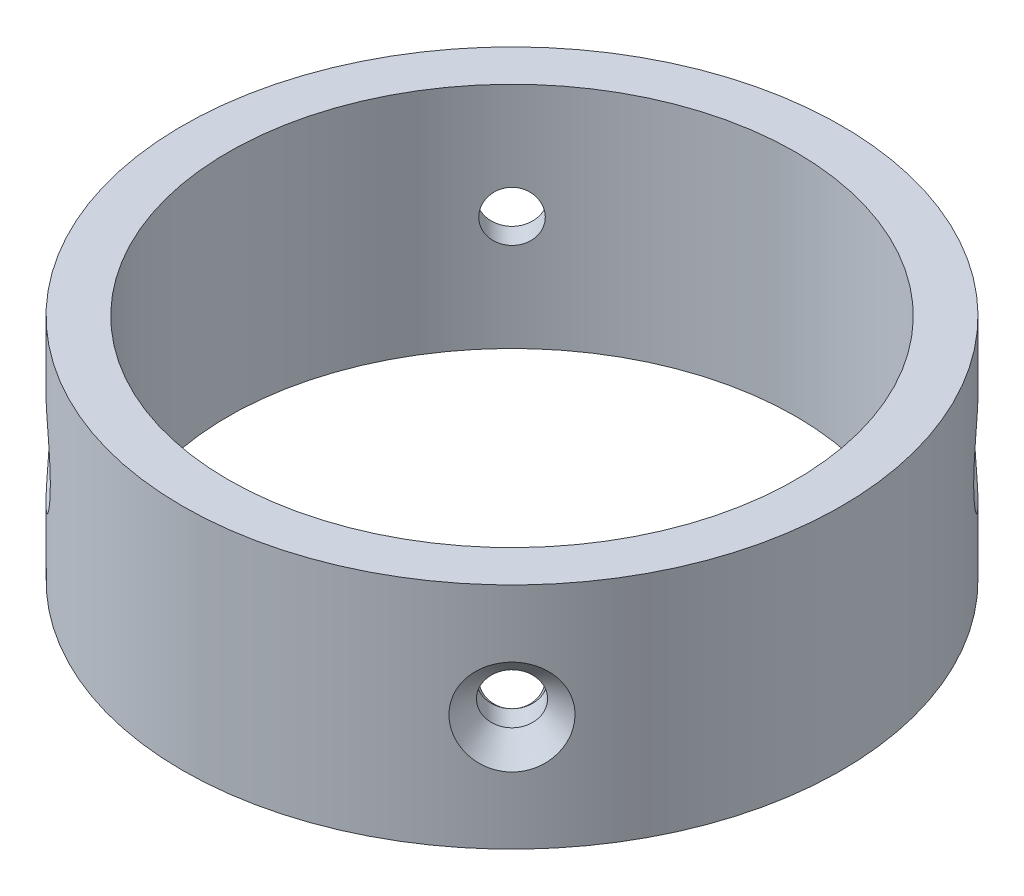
SolidWorks part; units mm, degrees
ref_plane "Plan de face" through (0, 0, 0) normal (0, 0, 1) x (1, 0, 0)
ref_plane "Plan de dessus" through (0, 0, 0) normal (0, 1, 0) x (1, 0, 0)
ref_plane "Plan de droite" through (0, 0, 0) normal (1, 0, 0) x (0, 0, -1)
sketch "Esquisse1" plane through (0, 0, 0) normal (0, 1, 0) x (1, 0, 0)
  line L0 (0, 0) -> (68.1408, -68.1408) construction
  line L1 (0, 0) -> (0, -68.5206) construction
  circle A0 centre (0, 0) radius 36
  circle A1 centre (0, 0) radius 31
  dimension "D1" = 72
  dimension "D3" = 45
  dimension "D2" = 5
extrude "Boss.-Extru.1" add sketch "Esquisse1" along normal blind 25
ref_plane "Plan3" through (25.4558, 0, 25.4558) normal (0.7071, 0, 0.7071) x (0.7071, 0, -0.7071)
sketch "Esquisse4" plane through (25.4558, 0, 25.4558) normal (0.7071, 0, 0.7071) x (0.7071, 0, -0.7071)
  line L0 (0, 25) -> (0, 0) construction
  line L1 (31, 25) -> (-31, 25) construction
  circle A0 centre (0, 12.5) radius 5
  dimension "D1" = 10
hole_wizard "Fraisage pour vis à tête fraisée M51" positions "Esquisse3D1" profile "Esquisse6" countersink size "M5" standard "ISO"
sketch3d "Esquisse3D1"
  line L0 (0, 0, 0) -> (0, 25, 0) construction
  line L1 (0, 25, 0) -> (0, 0, 0) construction
  line L2 (0, 25, 0) -> (0, 0, 0) construction
  line L5 (0, 25, 0) -> (40.1454, 25, 40.1454) construction
  line L8 (0, 25, 0) -> (0, 25, 56.4254) construction
  point P0 (25.4558, 12.5, 25.4558)
  dimension "D1" = 45
sketch "Esquisse6" plane through (25.4558, 12.5, 25.4558) normal (0, 1, 0) x (0.7071, 0, -0.7071)
  line L0 (0, 0) -> (0, 6.6524)
  line L1 (0, 6.6524) -> (2.75, 5)
  line L2 (2.75, 5) -> (2.75, 2.45)
  line L3 (2.75, 2.45) -> (5.2, 0)
  line L5 (5.2, 0) -> (0, 0)
  line L6 (-2.75, 2.45) -> (-5.2, 0) construction
  line L10 (0, 6.6524) -> (-2.75, 5) construction
  line L11 (0, -6.35) -> (0, 107.95) construction
  dimension "Diamètre du perçage" = 5.5
  dimension "Profondeur du perçage" = 5
  dimension "Diamètre du fraisage entrant" = 10.4
  dimension "Angle du fraisage entrant" = 90
  dimension "Angle de pointe" = 118
pattern_circular "Répétition circulaire3" count 4 over 360 about axis through (0, 25, 0) along (0, -1, 0) of "Fraisage pour vis à tête fraisée M51"
